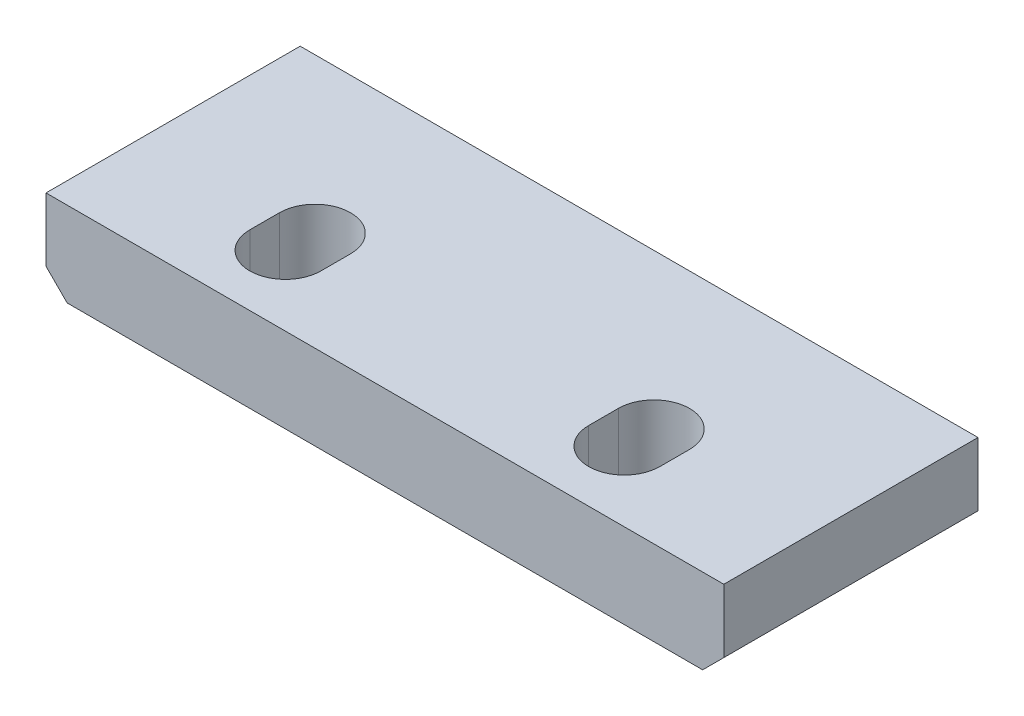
SolidWorks part; units mm, degrees
ref_plane "Front Plane" through (0, 0, 0) normal (0, 0, 1) x (1, 0, 0)
ref_plane "Top Plane" through (0, 0, 0) normal (0, 1, 0) x (1, 0, 0)
ref_plane "Right Plane" through (0, 0, 0) normal (1, 0, 0) x (0, 0, -1)
sketch "Sketch1" plane through (0, 0, 0) normal (0, 1, 0) x (1, 0, 0)
  line L0 (-12.7, -3.175) -> (0, -3.175) construction
  line L1 (25.4, -9.525) -> (-25.4, -9.525)
  line L2 (25.4, -9.525) -> (25.4, 9.525)
  line L3 (25.4, 9.525) -> (-25.4, 9.525)
  line L4 (-25.4, -9.525) -> (-25.4, 9.525)
  line L5 (25.4, -9.525) -> (-25.4, 9.525) construction
  line L6 (25.4, 9.525) -> (-25.4, -9.525) construction
  line L7 (0, -3.175) -> (12.7, -3.175) construction
  circle A0 centre (-12.7, -3.175) radius 2.667
  circle A1 centre (12.7, -3.175) radius 2.667
  point P0 (0, 0)
  dimension "D1" = 5.334
  dimension "D2" = 25.4
  dimension "D3" = 50.8
  dimension "D4" = 6.35
  dimension "D5" = 19.05
extrude "Boss-Extrude1" add sketch "Sketch1" along normal blind 6.35
chamfer "Chamfer1" distance 1.5875 angle 45 2 edges at (25.4, 0, 0) (-25.4, 0, 0)
sketch "Sketch2" plane through (0, 0, 0) normal (0, -1, 0) x (1, 0, 0)
  line L0 (-12.7, 3.175) -> (0, 3.175) construction
  line L1 (-12.7, 4.2861) -> (0, 3.175) construction
  line L2 (-12.7, 4.2861) -> (-12.7, 2.0639) construction
  line L3 (-10.033, 4.2861) -> (-10.033, 2.0639)
  line L4 (-15.367, 4.2861) -> (-15.367, 2.0639)
  arc A0 (-10.033, 4.2861) -> (-15.367, 4.2861) centre (-12.7, 4.2861) ccw
  arc A1 (-15.367, 2.0639) -> (-10.033, 2.0639) centre (-12.7, 2.0639) ccw
  circle A2 centre (-12.7, 3.175) radius 2.667 construction
  point P4 (-12.7, 3.175)
  dimension "D1" = 5
extrude "Cut-Extrude1" cut sketch "Sketch2" against normal through all
mirror "Mirror1" about plane through (0, 0, 0) normal (1, 0, 0) of "Cut-Extrude1"
